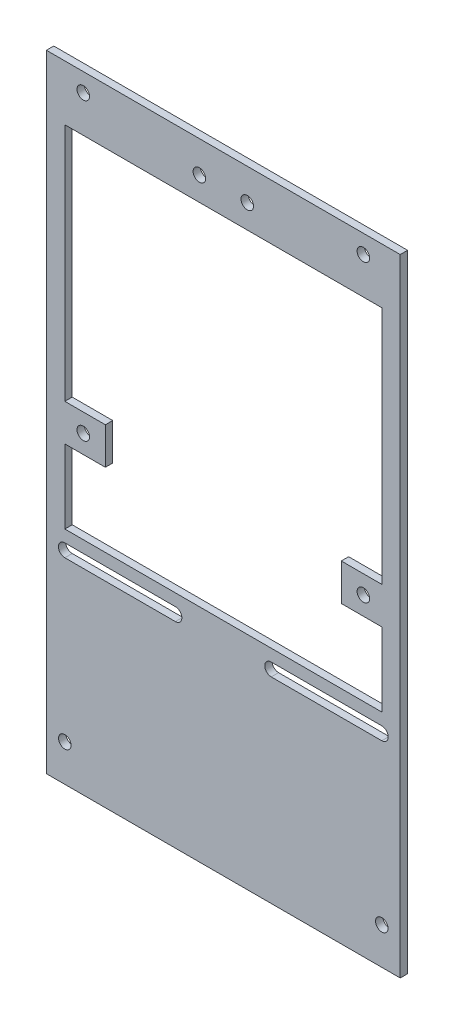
SolidWorks part; units mm, degrees
ref_plane "前视基准面" through (0, 0, 0) normal (0, 0, 1) x (1, 0, 0)
ref_plane "上视基准面" through (0, 0, 0) normal (0, 1, 0) x (1, 0, 0)
ref_plane "右视基准面" through (0, 0, 0) normal (1, 0, 0) x (0, 0, -1)
sketch "草图1" plane through (0, 0, 0) normal (0, 0, 1) x (1, 0, 0)
  line L1 (-47, 85) -> (47, 85)
  line L2 (-47, 85) -> (-47, -85)
  line L3 (-47, -85) -> (47, -85)
  line L4 (47, 85) -> (47, -85)
  line L5 (-47, 85) -> (47, -85) construction
  line L6 (-47, -85) -> (47, 85) construction
  point P0 (0, 0)
  dimension "D1" = 94
  dimension "D2" = 170
extrude "凸台-拉伸1" add sketch "草图1" along normal blind 2
hole_wizard "Ø3.4 (3.4) 直径孔1" positions "草图2" profile "草图3" hole size "Ø3.4" standard "GB"
sketch "草图2" plane through (0, 0, 0) normal (0, 0, -1) x (-1, 0, 0)
  point P0 (-6.5, 76.4436)
  point P3 (6.5, 76.4436)
sketch "草图3" plane through (6.5, 76.4436, 0) normal (1, 0, 0) x (0, 1, 0)
  line L0 (0, 0) -> (0, 2)
  line L1 (0, 2) -> (1.7, 2)
  line L2 (1.7, 2) -> (1.7, 0)
  line L5 (1.7, 0) -> (0, 0)
  line L11 (0, -6.35) -> (0, 107.95) construction
  dimension "通孔孔直径" = 3.4
  dimension "通孔孔深度" = 2
hole_wizard "Ø3.4 (3.4) 直径孔2" positions "草图4" profile "草图5" hole size "Ø3.4" standard "GB"
sketch "草图4" plane through (0, 0, 0) normal (0, 0, -1) x (-1, 0, 0)
  point P0 (-43, -75)
  point P3 (43, -75)
sketch "草图5" plane through (43, -75, 0) normal (1, 0, 0) x (0, 1, 0)
  line L0 (0, 0) -> (0, 2)
  line L1 (0, 2) -> (1.7, 2)
  line L2 (1.7, 2) -> (1.7, 0)
  line L5 (1.7, 0) -> (0, 0)
  line L11 (0, -6.35) -> (0, 107.95) construction
  dimension "通孔孔直径" = 3.4
  dimension "通孔孔深度" = 2
hole_wizard "Ø3.4 (3.4) 直径孔3" positions "草图6" profile "草图7" hole size "Ø3.4" standard "GB"
sketch "草图6" plane through (0, 0, 0) normal (0, 0, -1) x (-1, 0, 0)
  point P0 (-38, 80)
  point P3 (38, 80)
  point P6 (38, 0)
  point P9 (-38, 0)
sketch "草图7" plane through (38, 80, 0) normal (1, 0, 0) x (0, 1, 0)
  line L0 (0, 0) -> (0, 2)
  line L1 (0, 2) -> (1.7, 2)
  line L2 (1.7, 2) -> (1.7, 0)
  line L5 (1.7, 0) -> (0, 0)
  line L11 (0, -6.35) -> (0, 107.95) construction
  dimension "通孔孔直径" = 3.4
  dimension "通孔孔深度" = 2
sketch "草图8" plane through (0, 0, 2) normal (0, 0, 1) x (1, 0, 0)
  line L0 (-47, 85) -> (-47, -85) construction
  line L1 (-43, -5) -> (-32, -5)
  line L2 (-43, -5) -> (-43, -25)
  line L3 (-43, -25) -> (43, -25)
  line L4 (43, -5) -> (43, -25)
  line L5 (47, -85) -> (47, 85) construction
  line L6 (-47, -85) -> (47, -85) construction
  line L7 (47, 85) -> (-47, 85) construction
  line L8 (-32, 70) -> (32, 70)
  line L9 (-32, 5) -> (-32, -5)
  line L11 (32, 5) -> (32, -5)
  line L12 (32, 5) -> (43, 5)
  line L13 (-43, 70) -> (43, 70)
  line L14 (-43, 70) -> (-43, 5)
  line L15 (-43, 5) -> (-32, 5)
  line L16 (43, 70) -> (43, 5)
  line L17 (32, -5) -> (43, -5)
  dimension "D1" = 4
  dimension "D2" = 4
  dimension "D3" = 60
  dimension "D4" = 20
  dimension "D5" = 15
  dimension "D6" = 15
  dimension "D7" = 15
  dimension "D8" = 10
  dimension "D9" = 0
  dimension "D10" = 4
  dimension "D11" = 4
extrude "切除-拉伸1" cut sketch "草图8" against normal blind 10 contours L11 L8 L9 L1 | L4 L1 L2 L3
sketch "草图9" plane through (47, 0, 0) normal (1, 0, 0) x (0, 0, -1)
  line L4 (0, -85) -> (0, 85)
  line L5 (0, 85) -> (-2, 85)
  line L6 (-2, 85) -> (-2, -85)
  line L7 (-2, -85) -> (0, -85)
  line L8 (0, -85) -> (0, 85)
  line L9 (0, 85) -> (-2, 85)
  line L10 (-2, 85) -> (-2, -85)
  line L11 (-2, -85) -> (0, -85)
  dimension "D1" = 0
extrude "凸台-拉伸2" add sketch "草图9" along normal blind 1
sketch "草图10" plane through (-47, 0, 0) normal (-1, 0, 0) x (0, 0, 1)
  line L4 (0, 85) -> (0, -85)
  line L5 (0, -85) -> (2, -85)
  line L6 (2, -85) -> (2, 85)
  line L7 (2, 85) -> (0, 85)
  line L8 (0, 85) -> (0, -85)
  line L9 (0, -85) -> (2, -85)
  line L10 (2, -85) -> (2, 85)
  line L11 (2, 85) -> (0, 85)
  dimension "D1" = 0
extrude "凸台-拉伸3" add sketch "草图10" along normal blind 1
sketch "草图11" plane through (0, 0, 2) normal (0, 0, 1) x (1, 0, 0)
  line L0 (-43, -30) -> (-13, -30) construction
  line L1 (-43, -28.25) -> (-13, -28.25)
  line L2 (-43, -31.75) -> (-13, -31.75)
  line L3 (13, -30) -> (43, -30) construction
  line L4 (13, -28.25) -> (43, -28.25)
  line L5 (13, -31.75) -> (43, -31.75)
  line L6 (-48, -85) -> (-48, 85) construction
  line L7 (48, 85) -> (48, -85) construction
  line L8 (-43, -25) -> (43, -25) construction
  arc A0 (-43, -28.25) -> (-43, -31.75) centre (-43, -30) ccw
  arc A1 (-13, -31.75) -> (-13, -28.25) centre (-13, -30) ccw
  arc A2 (13, -28.25) -> (13, -31.75) centre (13, -30) ccw
  arc A3 (43, -31.75) -> (43, -28.25) centre (43, -30) ccw
  point P2 (-28, -30)
  point P7 (28, -30)
  dimension "D7" = 1.75
  dimension "D8" = 1.75
  dimension "D1" = 5
  dimension "D2" = 5
  dimension "D3" = 30
  dimension "D4" = 30
  dimension "D5" = 5
  dimension "D6" = 5
extrude "切除-拉伸2" cut sketch "草图11" against normal up to next
